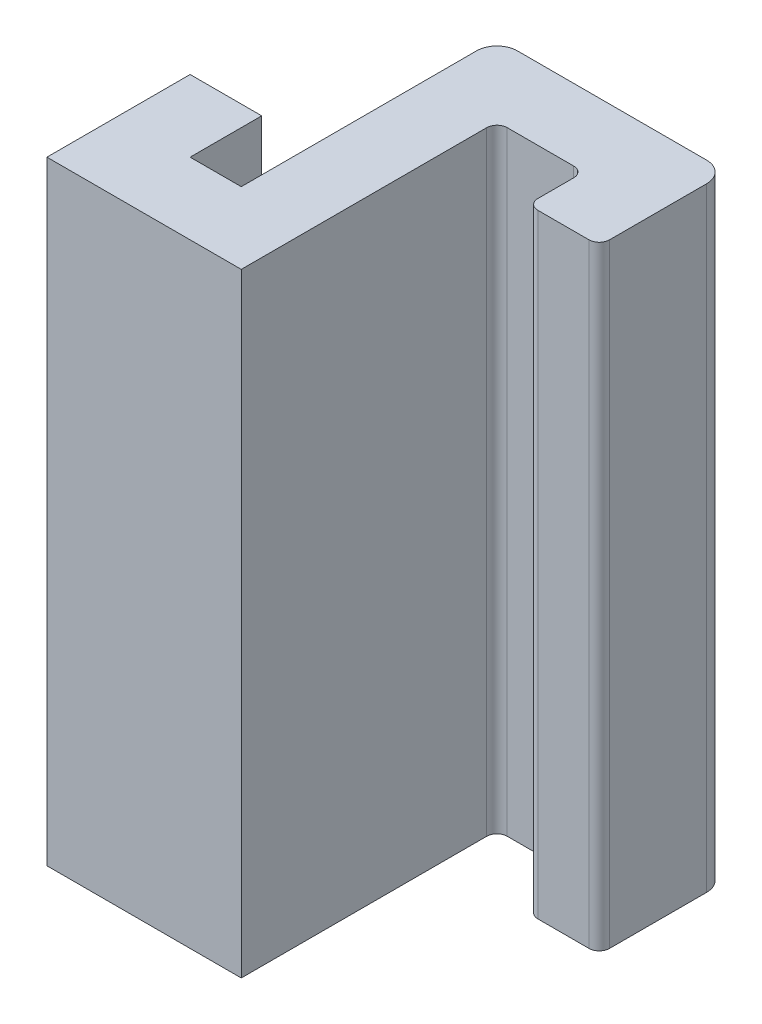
SolidWorks part; units mm, degrees
ref_plane "Спереди" through (0, 0, 0) normal (0, 0, 1) x (1, 0, 0)
ref_plane "Сверху" through (0, 0, 0) normal (0, 1, 0) x (1, 0, 0)
ref_plane "Справа" through (0, 0, 0) normal (1, 0, 0) x (0, 0, -1)
sketch "Эскиз1" plane through (0, 0, 0) normal (0, 1, 0) x (1, 0, 0)
  line L0 (0, 0) -> (-19, 0)
  line L1 (-19, 0) -> (-19, 14)
  line L2 (-19, 14) -> (-12, 14)
  line L3 (-12, 14) -> (-12, 7)
  line L4 (-12, 7) -> (-7, 7)
  line L5 (-7, 7) -> (-7, 32)
  line L6 (-7, 32) -> (15.5, 32)
  line L7 (15.5, 32) -> (15.5, 19.5)
  line L8 (15.5, 19.5) -> (8.5, 19.5)
  line L9 (0, 0) -> (0, 25)
  line L10 (0, 25) -> (8.5, 25)
  line L11 (8.5, 25) -> (8.5, 19.5)
extrude "Бобышка-Вытянуть1" add sketch "Эскиз1" along normal blind 60
fillet "Скругление1" radius 1 4 edges at (0, 30, -25) (8.5, 30, -25) (15.5, 30, -19.5) (8.5, 30, -19.5)
fillet "Скругление2" radius 2 1 edges at (15.5, 30, -32)
fillet "Скругление3" radius 2 1 edges at (-7, 30, -32)
